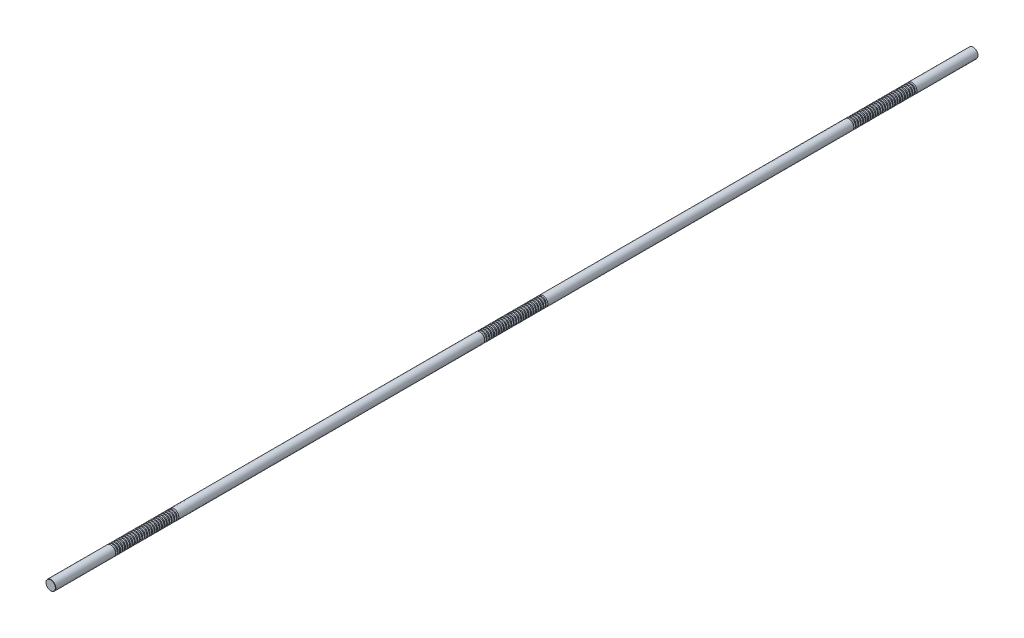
SolidWorks part; units mm, degrees
ref_plane "Front Plane" through (0, 0, 0) normal (0, 0, 1) x (1, 0, 0)
ref_plane "Top Plane" through (0, 0, 0) normal (0, 1, 0) x (1, 0, 0)
ref_plane "Right Plane" through (0, 0, 0) normal (1, 0, 0) x (0, 0, -1)
sketch "Sketch1" plane through (0, 0, 0) normal (0, 0, 1) x (1, 0, 0)
  circle A0 centre (0, 0) radius 8
  dimension "D1" = 16
extrude "Boss-Extrude1" add sketch "Sketch1" along normal mid plane 1500
chamfer "Chamfer1" distance 0.4 angle 45 2 edges at (8, 0, -750) (8, 0, 750)
sketch "Sketch2" plane through (0, 0, 0) normal (1, 0, 0) x (0, 0, -1)
  line L0 (650.3014, 8) -> (647.6986, 8)
  line L1 (749.6, 8) -> (-749.6, 8) construction
  line L2 (647.6986, 8) -> (648.3014, 5.75)
  line L3 (648.3014, 5.75) -> (649.6986, 5.75)
  line L4 (649.6986, 5.75) -> (650.3014, 8)
  line L5 (750, -7.6) -> (750, 7.6) construction
  point P4 (649, 8)
  point P7 (649, 5.75)
  point P8 (650, 6.875)
  point P9 (648, 6.875)
  dimension "D1" = 2
  dimension "D2" = 100
  dimension "D3" = 2.25
  dimension "D4" = 30
revolve "Cut-Revolve1" cut sketch "Sketch2" angle 360 about axis through (0, 0, 750) along (0, 0, -1)
pattern_linear "LPattern1" count 26 spacing 4 along (0, 0, 1) of "Cut-Revolve1"
pattern_linear "LPattern2" count 3 spacing 600 along (0, 0, 1) of "Cut-Revolve1", "LPattern1"
